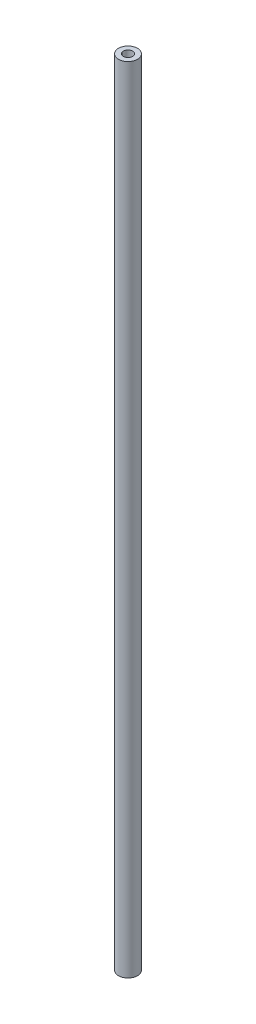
SolidWorks part; units mm, degrees
ref_plane "Front Plane" through (0, 0, 0) normal (0, 0, 1) x (1, 0, 0)
ref_plane "Top Plane" through (0, 0, 0) normal (0, 1, 0) x (1, 0, 0)
ref_plane "Right Plane" through (0, 0, 0) normal (1, 0, 0) x (0, 0, -1)
sketch "Sketch1" plane through (0, 0, 0) normal (0, 1, 0) x (1, 0, 0)
  circle A0 centre (0, 0) radius 10.668
  circle A1 centre (0, 0) radius 21.971
  dimension "D1" = 43.942
  dimension "D2" = 21.336
extrude "Boss-Extrude1" add sketch "Sketch1" along normal blind 1828.8
